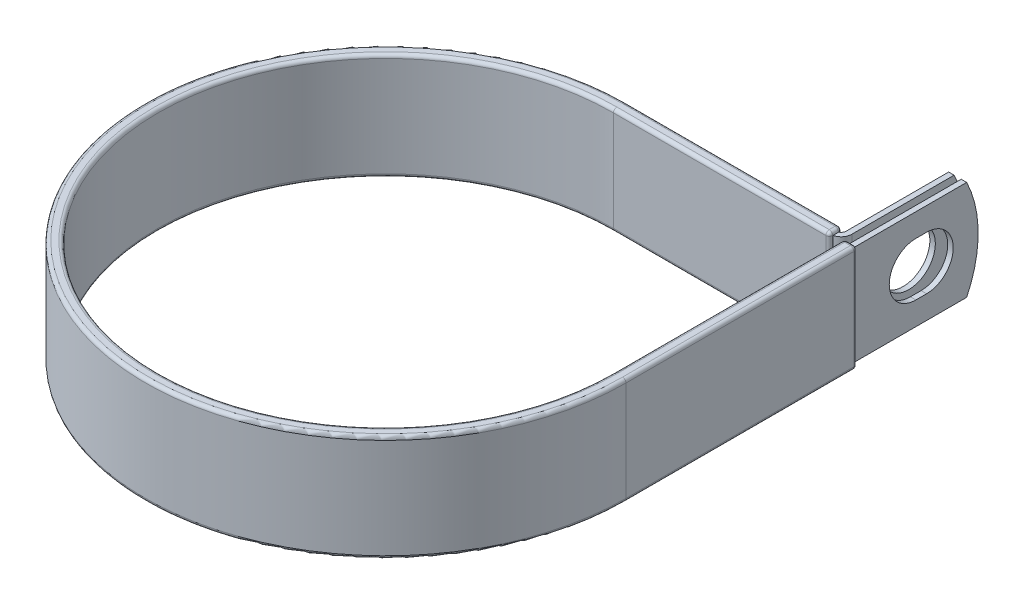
SolidWorks part; units mm, degrees
ref_plane "Front Plane" through (0, 0, 0) normal (0, 0, 1) x (1, 0, 0)
ref_plane "Top Plane" through (0, 0, 0) normal (0, 1, 0) x (1, 0, 0)
ref_plane "Right Plane" through (0, 0, 0) normal (1, 0, 0) x (0, 0, -1)
sketch "Sketch1" plane through (0, 0, 0) normal (0, 1, 0) x (1, 0, 0)
  line L0 (0, 51.5938) -> (47.6415, 51.5938)
  line L1 (51.5938, 0) -> (51.5938, 51.5938)
  line L2 (50.0189, 79.375) -> (50.0189, 53.9712)
  line L5 (51.5938, 51.5938) -> (51.5938, 79.375)
  arc A0 (0, 51.5938) -> (51.5938, 0) centre (0, 0) ccw
  arc A3 (47.6415, 51.5938) -> (50.0189, 53.9712) centre (47.6415, 53.9712) ccw
extrude "Extrude-Thin1" add sketch "Sketch1" along normal mid plane 22.225 thin
sketch "Sketch2" plane through (48.7997, 0, 0) normal (-1, 0, 0) x (0, 0, 1)
  line L0 (-79.375, 11.1125) -> (-79.375, -11.1125) construction
  line L7 (0, 11.1125) -> (0, -11.1125) construction
  circle A0 centre (-66.675, 0) radius 5.9436
  point P2 (-79.375, 0)
extrude "Cut-Extrude1" cut sketch "Sketch2" against normal up to surface (1.2192 mm away)
sketch "Sketch3" plane through (52.813, 0, 0) normal (1, 0, 0) x (0, 0, -1)
  line L0 (65.4812, 0) -> (67.8688, 0) construction
  line L1 (65.4812, 5.9436) -> (67.8688, 5.9436)
  line L2 (65.4812, -5.9436) -> (67.8688, -5.9436)
  line L3 (79.375, 11.1125) -> (79.375, -11.1125) construction
  arc A0 (65.4812, 5.9436) -> (65.4812, -5.9436) centre (65.4812, 0) ccw
  arc A1 (67.8688, -5.9436) -> (67.8688, 5.9436) centre (67.8688, 0) ccw
  point P3 (66.675, 0)
  point P8 (79.375, 0)
  point P11 (59.5376, 0)
  point P12 (73.8124, 0)
extrude "Cut-Extrude2" cut sketch "Sketch3" against normal up to surface (1.2192 mm away)
sketch "Sketch4" plane through (48.7997, 0, 0) normal (-1, 0, 0) x (0, 0, 1)
  line L0 (-79.375, 11.1125) -> (-79.375, -11.1125)
  line L1 (-79.375, 11.1125) -> (-76.8151, 11.1125)
  line L2 (-79.375, 11.1125) -> (-53.9712, 11.1125) construction
  line L3 (-79.375, -11.1125) -> (-76.8151, -11.1125)
  line L4 (-79.375, -11.1125) -> (-53.9712, -11.1125) construction
  arc A0 (-76.8151, 11.1125) -> (-76.8151, -11.1125) centre (-53.975, 0) ccw
extrude "Cut-Extrude3" cut sketch "Sketch4" against normal through all contours A0 M4 M5 | A0 L0 M2
ref_plane "Plane1" through (0, 0, -51.5938) normal (0, 0, 1) x (1, 0, 0)
ref_plane "Plane2" through (0, 0, 0) normal (-1, 0, 0) x (0, 0, 1)
sketch "Sketch5" plane through (0, 0, -51.5938) normal (0, 0, 1) x (1, 0, 0)
  line L0 (51.5938, 11.1125) -> (52.813, 11.1125)
  line L1 (51.5938, -11.1125) -> (51.5938, 11.1125)
  line L2 (50.8, -11.1442) -> (50.8, 11.1442)
  line L3 (52.813, 11.1125) -> (52.8129, -11.1125)
  line L4 (52.8129, -11.1125) -> (51.5938, -11.1125)
  line L5 (51.562, 11.9062) -> (52.8447, 11.9062)
  line L7 (53.6067, 11.1442) -> (53.6067, -11.1442)
  line L8 (52.8447, -11.9062) -> (51.562, -11.9062)
  line L9 (50.8, -11.9062) -> (50.8, 11.9062) construction
  line L11 (53.6067, -11.9062) -> (50.8, -11.9062) construction
  line L12 (53.6067, 11.9062) -> (53.6067, -11.9062) construction
  line L13 (50.8, 11.9062) -> (53.6067, 11.9062) construction
  arc A0 (50.8, -11.1442) -> (51.562, -11.9062) centre (51.562, -11.1442) ccw
  arc A1 (53.6067, -11.1442) -> (52.8447, -11.9062) centre (52.8447, -11.1442) cw
  arc A2 (50.8, 11.1442) -> (51.562, 11.9062) centre (51.562, 11.1442) cw
  arc A3 (52.8447, 11.9062) -> (53.6067, 11.1442) centre (52.8447, 11.1442) cw
sketch "Sketch6" plane through (0, 11.1125, 0) normal (0, 1, 0) x (1, 0, 0)
  line L0 (50.8, 0) -> (50.8, 51.5938)
  line L1 (0, 50.8) -> (48.1648, 50.8)
  line L2 (48.7998, 76.8151) -> (48.7998, 53.9712) construction
  arc A0 (0, 50.8) -> (50.8, 0) centre (0, 0) ccw
sweep "Sweep1" add profiles "Sketch5" path "Sketch6"
fillet "Fillet1" radius 0.762 16 edges at (48.1648, 11.6831, -53.3835) (48.1648, 0, -53.6067) (48.1648, -11.6831, -53.3835) (48.1648, -11.9062, -52.2033) (48.1648, -11.6831, -51.0232) (48.1648, 0, -50.8) (48.1648, 11.6831, -51.0232) (53.3835, 11.6831, -51.5938) (53.6067, 0, -51.5938) (53.3835, -11.6831, -51.5938) (52.2033, -11.9062, -51.5938) (51.0232, -11.6831, -51.5938) (50.8, 0, -51.5938) (51.0232, 11.6831, -51.5938) (48.1648, 11.9062, -52.2033) (52.2033, 11.9062, -51.5938)
equation "\"D4@Sketch5\" = \"D1@Extrude-Thin1\""
equation "\"D5@Sketch5\" = \"D5@Extrude-Thin1\""
equation "\"D1@Sketch3\" = \"D2@Sketch2\""
equation "\"D7@Sketch1\" = \"D3@Sketch2\" + \"D1@Sketch3\""
equation "\"D1@Sketch1\" = \"D1@Sketch6\" + 2 * \"D3@Sketch5\""
equation "\"D1@Sketch4\" = ( \"D1@Extrude-Thin1\" + .125 ) * 2"
equation "\"D2@Sketch1\"=1.95*\"D5@Extrude-Thin1\""
equation "\"D2@Sketch3\" = \"D1@Sketch2\""
